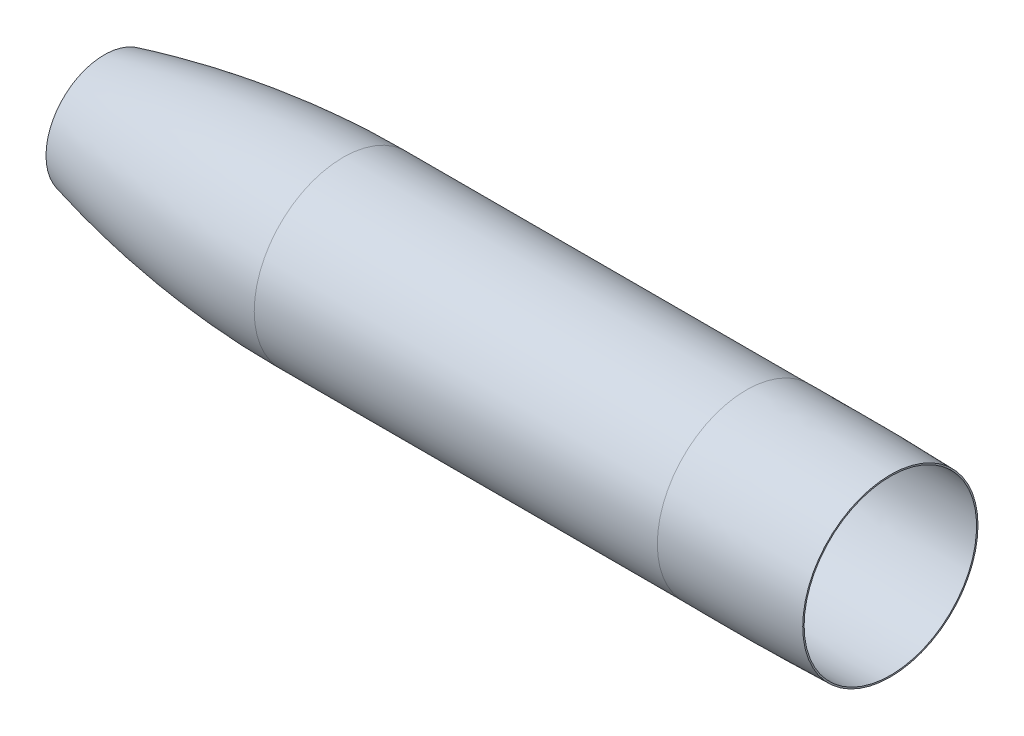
SolidWorks part; units mm, degrees
ref_plane "Front Plane" through (0, 0, 0) normal (0, 0, 1) x (1, 0, 0)
ref_plane "Top Plane" through (0, 0, 0) normal (0, 1, 0) x (1, 0, 0)
ref_plane "Right Plane" through (0, 0, 0) normal (1, 0, 0) x (0, 0, -1)
sketch "Sketch1" plane through (0, 0, 0) normal (0, 0, 1) x (1, 0, 0)
  line L0 (762, 265.3766) -> (762, 258.8208)
  line L1 (762, -265.3766) -> (762, 265.3766) construction
  line L2 (3686.81, 405.13) -> (1850.39, 405.13) construction
  line L3 (762, 258.8208) -> (763.5784, 259.2259)
  line L4 (4343.4, 399.2705) -> (4343.4, 392.9163)
  line L5 (4343.4, 399.2705) -> (4343.4, -399.2705) construction
  line L6 (3686.81, 405.13) -> (1850.39, 405.13)
  line L7 (4343.4, 392.9163) -> (4343.1703, 392.9247)
  line L8 (3686.81, 398.78) -> (1850.39, 398.78)
  line L9 (0, 0) -> (5618.4111, 0) construction
  spline S0 degree 3 poles (6105.8697, -2384.2299) (5927.0118, 137.5137) (3904.5653, 737.982) (1627.6976, -5.8877) (1997.2453, 2193.4675) knots -1.152888 -1.152888 -1.152888 -1.152888 0.339771 3.450801 3.450801 3.450801 3.450801 only from (5045.3781, 301.3798) to (3686.81, 405.13) construction
  spline S1 degree 3 poles (4629.5249, -589.8258) (2084.6797, 1343.1342) (-693.722, 207.8898) (-2332.3611, -1846.3182) knots -1.425816 -1.425816 -1.425816 -1.425816 2.529051 2.529051 2.529051 2.529051 only from (1850.39, 405.13) to (0, 0) construction
  spline S2 degree 3 poles (5043.2433, 295.3995) (5036.2752, 297.8869) (5022.276, 302.724) (4994.1895, 311.8122) (4958.8504, 322.1416) (4916.1229, 333.0113) (4858.7523, 345.6497) (4786.3575, 358.2985) (4698.6102, 369.5046) (4610.2034, 377.777) (4521.3799, 384.2651) (4432.4167, 389.3268) (4373.0472, 391.8421) (4343.4, 392.9163) knots 0 0 0 0 0.016191 0.032382 0.064763 0.097145 0.129527 0.19429 0.259054 0.323817 0.388581 0.453344 0.517941 0.517941 0.517941 0.517941 construction
  spline S4 degree 3 poles (4343.4, 399.2705) (4122.0322, 407.2848) (3900.6609, 405.13) (3686.81, 405.13) knots 0.518108 0.518108 0.518108 0.518108 1 1 1 1
  spline S5 degree 3 poles (1850.39, 405.13) (1480.6054, 405.13) (1116.3874, 356.3212) (762, 265.3766) knots 0 0 0 0 0.576959 0.576959 0.576959 0.576959
  spline S8 degree 1 poles (4343.1703, 392.9247) (3686.81, 398.78) knots 0 0 1 1 construction
  spline S9 degree 1 poles (1850.39, 398.78) (763.5784, 259.2259) knots 0 0 1 1 construction
  spline S10 degree 3 poles (4343.1703, 392.9247) (4315.5316, 393.9253) (4260.2226, 395.6101) (4149.7363, 397.9014) (4039.5719, 398.8651) (3930.0933, 399.0777) (3862.0266, 399.0179) (3807.8325, 398.9266) (3767.3263, 398.8545) (3733.7004, 398.8065) (3706.8737, 398.7842) (3693.5013, 398.78) (3686.81, 398.78) knots 0.518108 0.518108 0.518108 0.518108 0.578344 0.638581 0.759054 0.81929 0.879527 0.909645 0.939763 0.969882 0.984941 1 1 1 1
  spline S11 degree 3 poles (1850.39, 398.78) (1838.8571, 398.78) (1815.7835, 398.6848) (1769.7001, 398.1153) (1712.1743, 396.6957) (1643.2885, 393.8693) (1551.6379, 388.6169) (1437.4618, 379.2933) (1301.1187, 363.7698) (1165.4945, 343.9894) (1030.6353, 320.029) (896.604, 291.9698) (807.8026, 270.5749) (763.5784, 259.2259) knots 0 0 0 0 0.01803 0.03606 0.07212 0.10818 0.14424 0.21636 0.28848 0.3606 0.43272 0.50484 0.576959 0.576959 0.576959 0.576959
  dimension "D1" = 6.35
revolve "Revolve1" add sketch "Sketch1" angle 360 about L9
